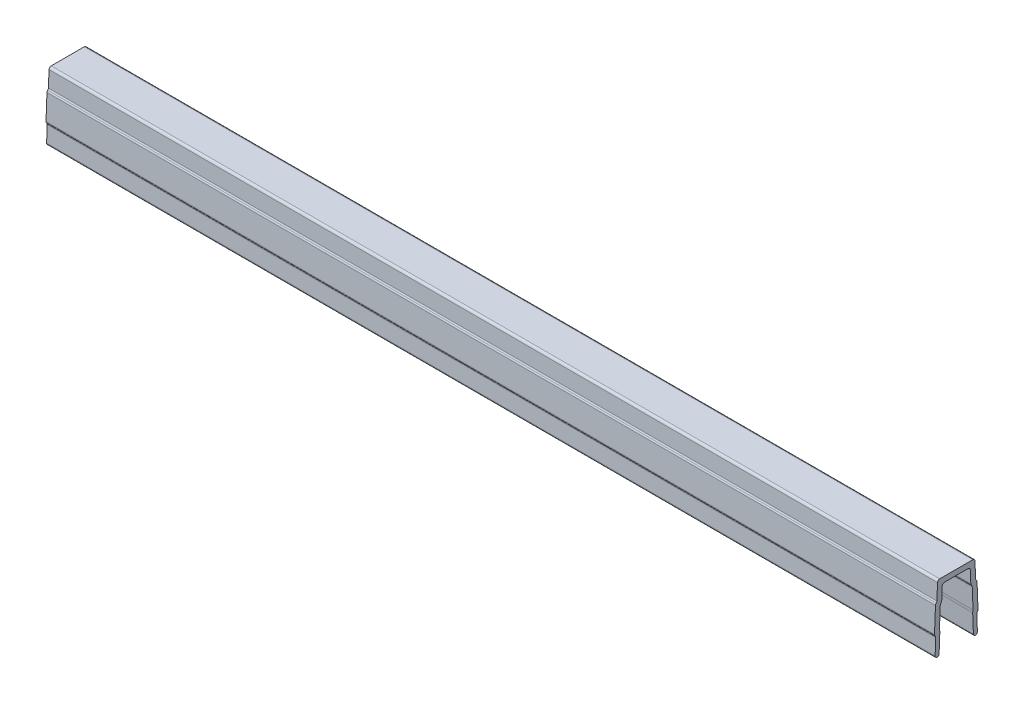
SolidWorks part; units mm, degrees
ref_plane "Front Plane" through (0, 0, 0) normal (0, 0, 1) x (1, 0, 0)
ref_plane "Top Plane" through (0, 0, 0) normal (0, 1, 0) x (1, 0, 0)
ref_plane "Right Plane" through (0, 0, 0) normal (1, 0, 0) x (0, 0, -1)
sketch3d "3DSketch1"
  line L0 (0, 0, 0) -> (200, 0, 0)
other "Peitelistat 1.6007 PEITELISTA 45 VAALEANHARMAA(1)"
ref_plane "Plane1" through (0, 0, 0) normal (1, 0, 0) x (0, 0, -1)
sketch "Sketch1" plane through (0, 0, 0) normal (1, 0, 0) x (0, 0, -1)
  line L0 (-4.8119, 2.8665) -> (-5.0257, -2.701)
  line L1 (-4.893, -3.0599) -> (-4.8861, -3.0673)
  line L2 (-4.7534, -3.4262) -> (-4.8894, -6.9673)
  line L3 (-3.9901, -7.0019) -> (-3.8259, -2.7273)
  line L4 (-3.9091, -2.2879) -> (-3.7302, 2.369)
  line L5 (-3.5702, 2.7166) -> (-3.5629, 2.7235)
  line L6 (-3.403, 3.0711) -> (-3.2949, 5.8849)
  line L7 (-2.7952, 6.3657) -> (2.533, 6.3657)
  line L8 (3.0327, 5.8849) -> (3.1407, 3.0711)
  line L9 (3.3007, 2.7235) -> (3.308, 2.7166)
  line L10 (3.4679, 2.369) -> (3.6468, -2.2879)
  line L11 (3.5636, -2.7273) -> (3.7279, -7.0019)
  line L12 (4.6272, -6.9673) -> (4.4912, -3.4262)
  line L13 (4.6239, -3.0673) -> (4.6308, -3.0599)
  line L14 (4.7635, -2.701) -> (4.5496, 2.8665)
  line L15 (4.3897, 3.2142) -> (4.3824, 3.221)
  line L16 (4.2224, 3.5687) -> (4.0874, 7.0849)
  line L17 (3.5877, 7.5657) -> (-3.8499, 7.5657)
  line L18 (-4.3496, 7.0849) -> (-4.4847, 3.5687)
  line L19 (-4.6446, 3.221) -> (-4.6519, 3.2142)
  arc A0 (-4.6519, 3.2142) -> (-4.8119, 2.8665) centre (-4.3122, 2.8473) ccw
  arc A1 (-5.0257, -2.701) -> (-4.893, -3.0599) centre (-4.5261, -2.7202) ccw
  arc A2 (-4.7534, -3.4262) -> (-4.8861, -3.0673) centre (-5.253, -3.407) ccw
  arc A3 (-4.8894, -6.9673) -> (-3.9901, -7.0019) centre (-4.4397, -6.9846) ccw
  arc A4 (-3.8259, -2.7273) -> (-3.8675, -2.5076) centre (-4.3255, -2.7081) ccw
  arc A5 (-3.9091, -2.2879) -> (-3.8675, -2.5076) centre (-3.4094, -2.3071) ccw
  arc A6 (-3.5702, 2.7166) -> (-3.7302, 2.369) centre (-3.2305, 2.3498) ccw
  arc A7 (-3.5629, 2.7235) -> (-3.403, 3.0711) centre (-3.9026, 3.0903) ccw
  arc A8 (-2.7952, 6.3657) -> (-3.2949, 5.8849) centre (-2.7952, 5.8657) ccw
  arc A9 (3.0327, 5.8849) -> (2.533, 6.3657) centre (2.533, 5.8657) ccw
  arc A10 (3.1407, 3.0711) -> (3.3007, 2.7235) centre (3.6404, 3.0903) ccw
  arc A11 (3.4679, 2.369) -> (3.308, 2.7166) centre (2.9683, 2.3498) ccw
  arc A12 (3.6052, -2.5076) -> (3.6468, -2.2879) centre (3.1472, -2.3071) ccw
  arc A13 (3.6052, -2.5076) -> (3.5636, -2.7273) centre (4.0633, -2.7081) ccw
  arc A14 (3.7279, -7.0019) -> (4.6272, -6.9673) centre (4.1775, -6.9846) ccw
  arc A15 (4.6239, -3.0673) -> (4.4912, -3.4262) centre (4.9908, -3.407) ccw
  arc A16 (4.6308, -3.0599) -> (4.7635, -2.701) centre (4.2639, -2.7202) ccw
  arc A17 (4.5496, 2.8665) -> (4.3897, 3.2142) centre (4.05, 2.8473) ccw
  arc A18 (4.2224, 3.5687) -> (4.3824, 3.221) centre (4.7221, 3.5879) ccw
  arc A19 (4.0874, 7.0849) -> (3.5877, 7.5657) centre (3.5877, 7.0657) ccw
  arc A20 (-3.8499, 7.5657) -> (-4.3496, 7.0849) centre (-3.8499, 7.0657) ccw
  arc A21 (-4.6446, 3.221) -> (-4.4847, 3.5687) centre (-4.9843, 3.5879) ccw
  point P64 (0, 0)
